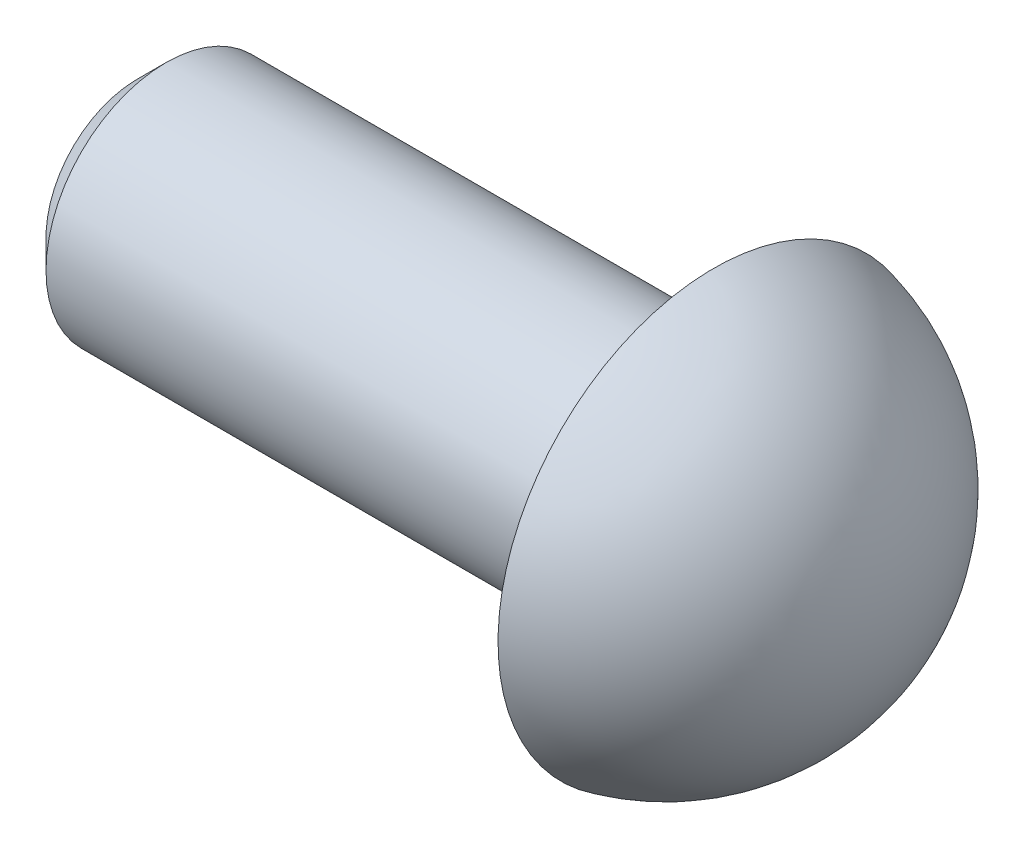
SolidWorks part; units mm, degrees
ref_plane "Plan de face" through (0, 0, 0) normal (0, 0, 1) x (1, 0, 0)
ref_plane "Plan de dessus" through (0, 0, 0) normal (0, 1, 0) x (1, 0, 0)
ref_plane "Plan de droite" through (0, 0, 0) normal (1, 0, 0) x (0, 0, -1)
sketch "Esquisse1" plane through (0, 0, 0) normal (0, 0, 1) x (1, 0, 0)
  line L0 (0, -2.25) -> (0, -1.25)
  line L1 (0, -1.25) -> (-6, -1.25)
  line L2 (-6, -1.25) -> (-6, 0)
  line L3 (1.823, 0) -> (-6, 0) construction
  line L4 (-6, 0) -> (1.823, 0) construction
  arc A0 (0, -2.25) -> (1.823, 0) centre (-0.477, 0) ccw
sketch "Esquisse2" plane through (0, 0, 0) normal (0, 0, 1) x (1, 0, 0)
  line L0 (0, -2.245) -> (0, -1.25)
  line L1 (0, -1.25) -> (-6, -1.25)
  line L2 (-6, -1.25) -> (-6, 0)
  line L3 (1.823, 0) -> (-6, 0) construction
  line L4 (-6, 0) -> (1.8, 0)
  arc A0 (0, -2.245) -> (1.8, 0) centre (-0.5, 0) ccw
  dimension "D4" = 2.3
  dimension "D1" = 1.25
  dimension "D2" = 6
  dimension "D3" = 1.8
revolve "Révolution2" add sketch "Esquisse2" angle 360 about L3
chamfer "Chanfrein1" distance 0.3 angle 45 1 edges at (-6, 0, -1.25)
